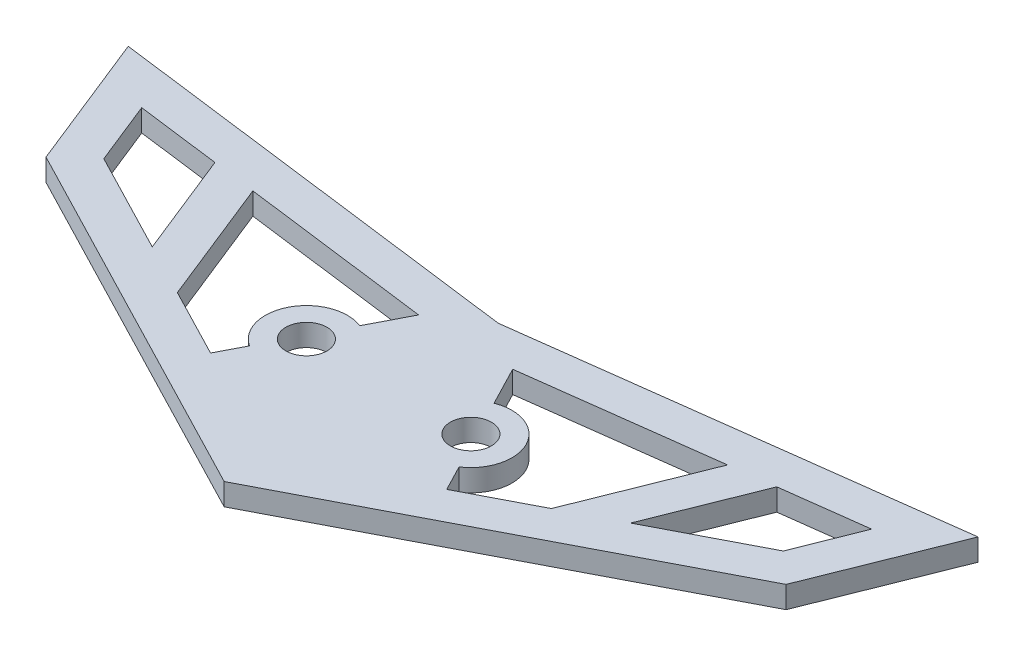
SolidWorks part; units mm, degrees
ref_plane "Face" through (0, 0, 0) normal (0, 0, 1) x (1, 0, 0)
ref_plane "Dessus" through (0, 0, 0) normal (0, 1, 0) x (1, 0, 0)
ref_plane "Droite" through (0, 0, 0) normal (1, 0, 0) x (0, 0, -1)
sketch "Esquisse1" plane through (0, 0, 0) normal (0, 1, 0) x (1, 0, 0)
  line L0 (0, 0) -> (13.5, 7)
  line L1 (13.5, 7) -> (15.5, 12)
  line L2 (15.5, 12) -> (0, 10)
  line L3 (0, 10) -> (0, 0)
  circle A0 centre (3, 6) radius 0.75
  dimension "D6" = 1.5
  dimension "D1" = 15.5
  dimension "D2" = 13.5
  dimension "D3" = 5
  dimension "D4" = 10
  dimension "D5" = 7
  dimension "D7" = 3
  dimension "D8" = 6
extrude "Extrusion1" add sketch "Esquisse1" along normal blind 0.8
sketch "Esquisse3" plane through (0, 0.8, 0) normal (0, 1, 0) x (-1, 0, 0)
  line L0 (-10.2485, -9.9108) -> (-13.3147, -10.3064)
  line L1 (-13.3147, -10.3064) -> (-12.3935, -8.0032)
  line L2 (-12.3935, -8.0032) -> (-8.7245, -6.1008)
  line L3 (-8.7245, -6.1008) -> (-10.2485, -9.9108)
  line L4 (-15.5, -12) -> (0, -10) construction
  line L5 (0, 0) -> (-13.5, -7) construction
  line L6 (-13.5, -7) -> (-15.5, -12) construction
  line L7 (-8.6586, -9.7056) -> (-6.8221, -5.1144)
  line L8 (-6.8221, -5.1144) -> (-4.3082, -3.8109)
  line L9 (-2.4496, -7.3954) -> (-1.7161, -8.8098)
  line L10 (-1.7161, -8.8098) -> (-8.6586, -9.7056)
  line L11 (-3.8232, -4.7461) -> (-4.3082, -3.8109)
  arc A0 (-3.8232, -4.7461) -> (-2.4496, -7.3954) centre (-3, -6) ccw
  dimension "D7" = 1.5
  dimension "D1" = 1.4
  dimension "D2" = 1.4
  dimension "D3" = 1.4
  dimension "D4" = 2.7
  dimension "D5" = 1.4
  dimension "D6" = 7
extrude "Extrusion2" cut sketch "Esquisse3" against normal through all
mirror "Symétrie1" about plane through (0, 0.8, -10) normal (1, 0, 0)
